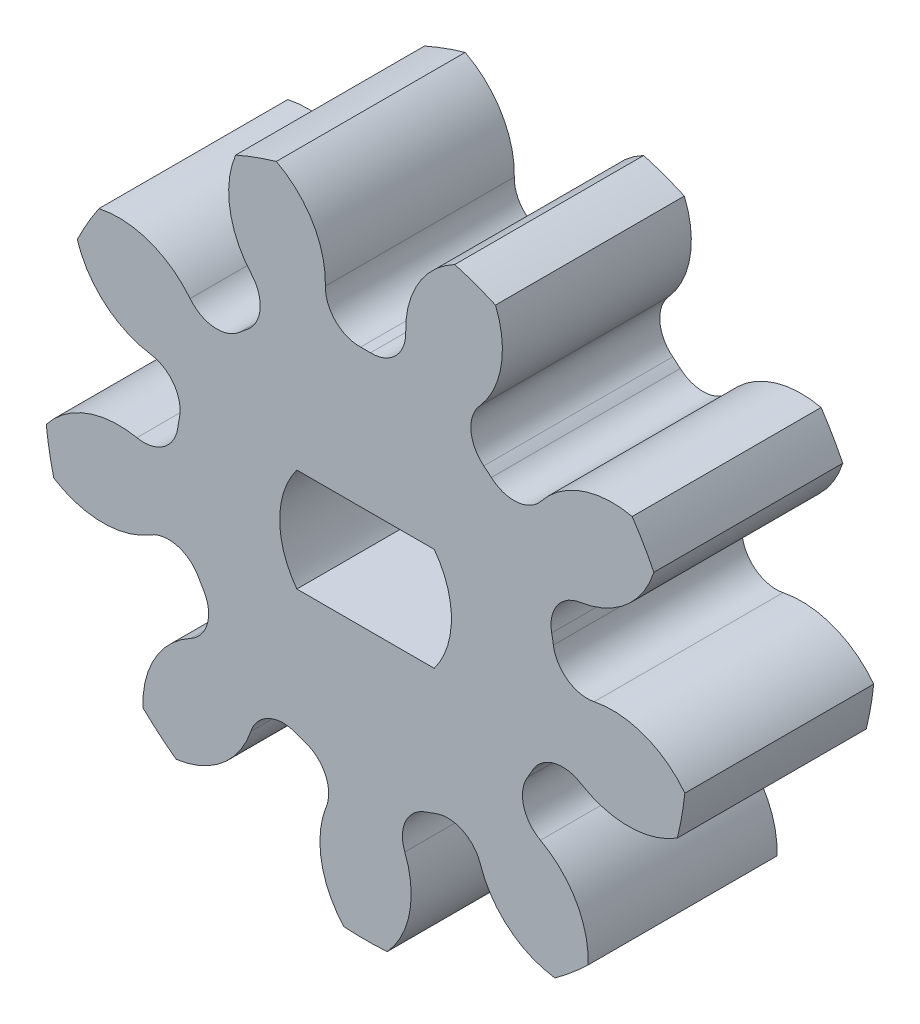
SolidWorks part; units mm, degrees
ref_plane "Front Plane" through (0, 0, 0) normal (0, 0, 1) x (1, 0, 0)
ref_plane "Top Plane" through (0, 0, 0) normal (0, 1, 0) x (1, 0, 0)
ref_plane "Right Plane" through (0, 0, 0) normal (1, 0, 0) x (0, 0, -1)
sketch "Sketch1" plane through (0, 0, 0) normal (0, 0, 1) x (1, 0, 0)
  line L0 (0, 0) -> (5.53, 0) construction
  line L1 (0, 0) -> (5.1965, -1.8914) construction
  line L2 (0, 0) -> (7.5338, -1.3284) construction
  arc A0 (7.1886, -2.6165) -> (7.65, 0) centre (0, 0) ccw construction
  arc A1 (9.0775, -2.2407) -> (9.2965, -0.9991) centre (0, 0) ccw
  arc A2 (-5.4192, 1.1013) -> (-5.4691, 0.8186) centre (0, 0) ccw
  arc A3 (9.2965, -0.9991) -> (6.6578, -0.0132) centre (7.1886, -2.6165) ccw
  circle A4 centre (0, 0) radius 7.65 construction
  arc A5 (9.0775, -2.2407) -> (6.2608, -2.2647) centre (7.65, 0) cw
  circle A6 centre (0, 0) radius 9.35 construction
  arc A7 (6.4793, -6.741) -> (5.0917, -4.2897) centre (3.825, -6.6251) ccw
  arc A8 (5.5135, -7.5514) -> (6.4793, -6.741) centre (0, 0) ccw
  arc A9 (5.5135, -7.5514) -> (3.3404, -5.7593) centre (5.8602, -4.9173) cw
  arc A10 (0.6304, -9.3287) -> (1.1431, -6.559) centre (-1.3284, -7.5338) ccw
  arc A11 (-0.6304, -9.3287) -> (0.6304, -9.3287) centre (0, 0) ccw
  arc A12 (-0.6304, -9.3287) -> (-1.1431, -6.559) centre (1.3284, -7.5338) cw
  arc A13 (-5.5135, -7.5514) -> (-3.3404, -5.7593) centre (-5.8602, -4.9173) ccw
  arc A14 (-6.4793, -6.741) -> (-5.5135, -7.5514) centre (0, 0) ccw
  arc A15 (-6.4793, -6.741) -> (-5.0917, -4.2897) centre (-3.825, -6.6251) cw
  arc A16 (-9.0775, -2.2407) -> (-6.2608, -2.2647) centre (-7.65, 0) ccw
  arc A17 (-9.2965, -0.9991) -> (-9.0775, -2.2407) centre (0, 0) ccw
  arc A18 (-9.2965, -0.9991) -> (-6.6578, -0.0132) centre (-7.1886, -2.6165) cw
  arc A19 (-8.3941, 4.1184) -> (-6.2518, 2.2895) centre (-5.8602, 4.9173) ccw
  arc A20 (-7.7637, 5.2103) -> (-8.3941, 4.1184) centre (0, 0) ccw
  arc A21 (-7.7637, 5.2103) -> (-5.1087, 4.2695) centre (-7.1886, 2.6165) cw
  arc A22 (-3.783, 8.5505) -> (-3.3175, 5.7725) centre (-1.3284, 7.5338) ccw
  arc A23 (-2.5983, 8.9817) -> (-3.783, 8.5505) centre (0, 0) ccw
  arc A24 (-2.5983, 8.9817) -> (-1.1691, 6.5544) centre (-3.825, 6.6251) cw
  arc A25 (2.5983, 8.9817) -> (1.1691, 6.5544) centre (3.825, 6.6251) ccw
  arc A26 (3.783, 8.5505) -> (2.5983, 8.9817) centre (0, 0) ccw
  arc A27 (3.783, 8.5505) -> (3.3175, 5.7725) centre (1.3284, 7.5338) cw
  arc A28 (7.7637, 5.2103) -> (5.1087, 4.2695) centre (7.1886, 2.6165) ccw
  arc A29 (8.3941, 4.1184) -> (7.7637, 5.2103) centre (0, 0) ccw
  arc A30 (8.3941, 4.1184) -> (6.2518, 2.2895) centre (5.8602, 4.9173) cw
  circle A31 centre (0, 0) radius 5.53 construction
  arc A32 (-3.4435, 4.3271) -> (-3.6634, 4.1425) centre (0, 0) ccw
  arc A33 (0.1435, 5.5281) -> (-0.1435, 5.5281) centre (0, 0) ccw
  arc A34 (3.6634, 4.1425) -> (3.4435, 4.3271) centre (0, 0) ccw
  arc A35 (5.4691, 0.8186) -> (5.4192, 1.1013) centre (0, 0) ccw
  arc A36 (1.7559, -5.2438) -> (2.0256, -5.1457) centre (0, 0) ccw
  arc A37 (4.7157, -2.8884) -> (4.8593, -2.6398) centre (0, 0) ccw
  arc A38 (-2.0256, -5.1457) -> (-1.7559, -5.2438) centre (0, 0) ccw
  arc A39 (-4.8593, -2.6398) -> (-4.7157, -2.8884) centre (0, 0) ccw
  arc A40 (-0.1435, 5.5281) -> (-1.1691, 6.5544) centre (-0.1695, 6.5278) cw
  arc A41 (0.1435, 5.5281) -> (1.1691, 6.5544) centre (0.1695, 6.5278) ccw
  arc A42 (3.4435, 4.3271) -> (3.3175, 5.7725) centre (4.0662, 5.1095) cw
  arc A43 (3.6634, 4.1425) -> (5.1087, 4.2695) centre (4.3258, 4.8916) ccw
  arc A44 (5.4192, 1.1013) -> (6.2518, 2.2895) centre (6.3992, 1.3004) cw
  arc A45 (5.4691, 0.8186) -> (6.6578, -0.0132) centre (6.4581, 0.9666) ccw
  arc A46 (-3.6634, 4.1425) -> (-5.1087, 4.2695) centre (-4.3258, 4.8916) cw
  arc A47 (-3.4435, 4.3271) -> (-3.3175, 5.7725) centre (-4.0662, 5.1095) ccw
  arc A48 (-5.4691, 0.8186) -> (-6.6578, -0.0132) centre (-6.4581, 0.9666) cw
  arc A49 (-6.2518, 2.2895) -> (-5.4192, 1.1013) centre (-6.3992, 1.3004) cw
  arc A50 (-4.7157, -2.8884) -> (-5.0917, -4.2897) centre (-5.5685, -3.4107) cw
  arc A51 (-4.8593, -2.6398) -> (-6.2608, -2.2647) centre (-5.738, -3.1171) ccw
  arc A52 (-2.0256, -5.1457) -> (-3.3404, -5.7593) centre (-2.3919, -6.0762) ccw
  arc A53 (-1.7559, -5.2438) -> (-1.1431, -6.559) centre (-2.0734, -6.1921) cw
  arc A54 (1.7559, -5.2438) -> (1.1431, -6.559) centre (2.0734, -6.1921) ccw
  arc A55 (2.0256, -5.1457) -> (3.3404, -5.7593) centre (2.3919, -6.0762) cw
  arc A56 (4.7157, -2.8884) -> (5.0917, -4.2897) centre (5.5685, -3.4107) ccw
  arc A57 (6.2608, -2.2647) -> (4.8593, -2.6398) centre (5.738, -3.1171) ccw
  point P66 (0, 0)
  point P77 (5.5011, -0.5644)
  point P102 (5.3624, -1.3511)
  dimension "D1" = 15.3
  dimension "D2" = 1.7
  dimension "D3" = 2.12
  dimension "D6" = 1
  dimension "D7" = 1
  dimension "D8" = 1
  dimension "D9" = 1
  dimension "D10" = 1
  dimension "D11" = 1
  dimension "D12" = 1
  dimension "D13" = 1
  dimension "D14" = 1
  dimension "D15" = 1
  dimension "D16" = 1
  dimension "D17" = 1
  dimension "D18" = 1
  dimension "D19" = 1
  dimension "D20" = 1
  dimension "D21" = 1
  dimension "D22" = 1
  dimension "D23" = 1
  dimension "D4" = 20
  dimension "D5" = 9
extrude "Boss-Extrude1" add sketch "Sketch1" along normal mid plane 5.5
sketch "Sketch2" plane through (0, 0, 2.75) normal (0, 0, 1) x (1, 0, 0)
  line L0 (-2, 1.5) -> (2, 1.5)
  line L1 (-2, -1.5) -> (2, -1.5)
  circle A0 centre (0, 0) radius 2.5
  dimension "D1" = 1.5
  dimension "D2" = 5
  dimension "D3" = 1.5
extrude "Cut-Extrude1" cut sketch "Sketch2" against normal blind 5.5 contours L0 A0 L1
